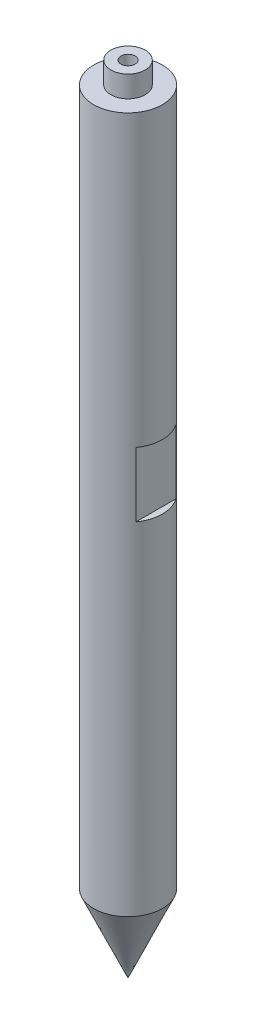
SolidWorks part; units mm, degrees
ref_plane "前视基准面" through (0, 0, 0) normal (0, 0, 1) x (1, 0, 0)
ref_plane "上视基准面" through (0, 0, 0) normal (0, 1, 0) x (1, 0, 0)
ref_plane "右视基准面" through (0, 0, 0) normal (1, 0, 0) x (0, 0, -1)
sketch "草图1" plane through (0, 0, 0) normal (0, 0, 1) x (1, 0, 0)
  line L9 (0, 0) -> (-8, 0)
  line L10 (-8, 0) -> (-8, -162)
  line L14 (0, -180) -> (0, 0)
  line L16 (-8, -162) -> (0, -180)
revolve "旋转1" add sketch "草图1" angle 360 about L14
sketch "草图4" plane through (0, 0, 0) normal (0, 1, 0) x (1, 0, 0)
  line L0 (0, 8) -> (0, -8) construction
  circle A1 centre (0, 0) radius 8 construction
  point P5 (0, 0)
ref_plane "基准面1" through (0, 0, 10.5) normal (0, 0, 1) x (1, 0, 0)
sketch "草图10" plane through (0, 0, 0) normal (0, 1, 0) x (1, 0, 0)
  circle A0 centre (0, 0) radius 4
  dimension "D1" = 8
extrude "凸台-拉伸1" add sketch "草图10" along normal blind 5
sketch "草图19" plane through (0, 0, 0) normal (0, 0, 1) x (1, 0, 0)
  line L0 (0, 5) -> (0, -180) construction
  line L1 (4, 5) -> (-4, 5) construction
  line L3 (-6.5, -82.5) -> (6.5, -82.5) construction
  line L4 (-6.5, -82.5) -> (-6.5, -67.5) construction
  line L5 (-6.5, -67.5) -> (6.5, -67.5) construction
  line L6 (6.5, -82.5) -> (6.5, -67.5) construction
  line L7 (-6.5, -82.5) -> (6.5, -67.5) construction
  line L8 (-6.5, -67.5) -> (6.5, -82.5) construction
  line L9 (6.5, -67.5) -> (46.5, -67.5)
  line L10 (6.5, -67.5) -> (6.5, -82.5)
  line L11 (6.5, -82.5) -> (46.5, -82.5)
  line L12 (46.5, -67.5) -> (46.5, -82.5)
  line L13 (-6.5, -67.5) -> (-46.5, -67.5)
  line L14 (-6.5, -67.5) -> (-6.5, -82.5)
  line L15 (-6.5, -82.5) -> (-46.5, -82.5)
  line L16 (-46.5, -67.5) -> (-46.5, -82.5)
  point P5 (0, -75)
extrude "切除-拉伸1" cut sketch "草图19" against normal through all and the other way through all
hole_wizard "M4 螺纹孔1" positions "草图21" profile "草图22" tap size "M4" standard "ISO"
sketch "草图21" plane through (0, 5, 0) normal (0, 1, 0) x (1, 0, 0)
  point P0 (0, 0)
sketch "草图22" plane through (0, 5, 0) normal (1, 0, 0) x (0, 0, 1)
  line L0 (0, 0) -> (0, 11.0914)
  line L1 (0, 11.0914) -> (1.65, 10.1)
  line L2 (1.65, 10.1) -> (1.65, 0)
  line L5 (1.65, 0) -> (0, 0)
  line L10 (0, 11.0914) -> (-1.65, 10.1) construction
  line L11 (0, -6.35) -> (0, 107.95) construction
  dimension "螺纹孔钻头直径" = 3.3
  dimension "螺纹孔钻头深度" = 10.1
  dimension "导头角度" = 118
equation "\"总长度\"= 180"
equation "\"顶螺纹长度\"=5"
equation "\"台阶长度\"= 10"
equation "\"顶尖长度\"= 15"
equation "\"中段长度\"= \"总长度\" - \"顶螺纹长度\" - \"顶螺纹长度\" - \"台阶长度\""
equation "\"D4@草图1\"=\"总长度\""
equation "\"半径\"= 8"
equation "\"D1@凸台-拉伸1\"=\"顶螺纹长度\""
equation "\"D1@草图19\"=\"中段长度\"/2"
equation "\"D2@草图19\"=\"半径\"*2-3"
equation "\"D1@草图1\"=\"半径\""
